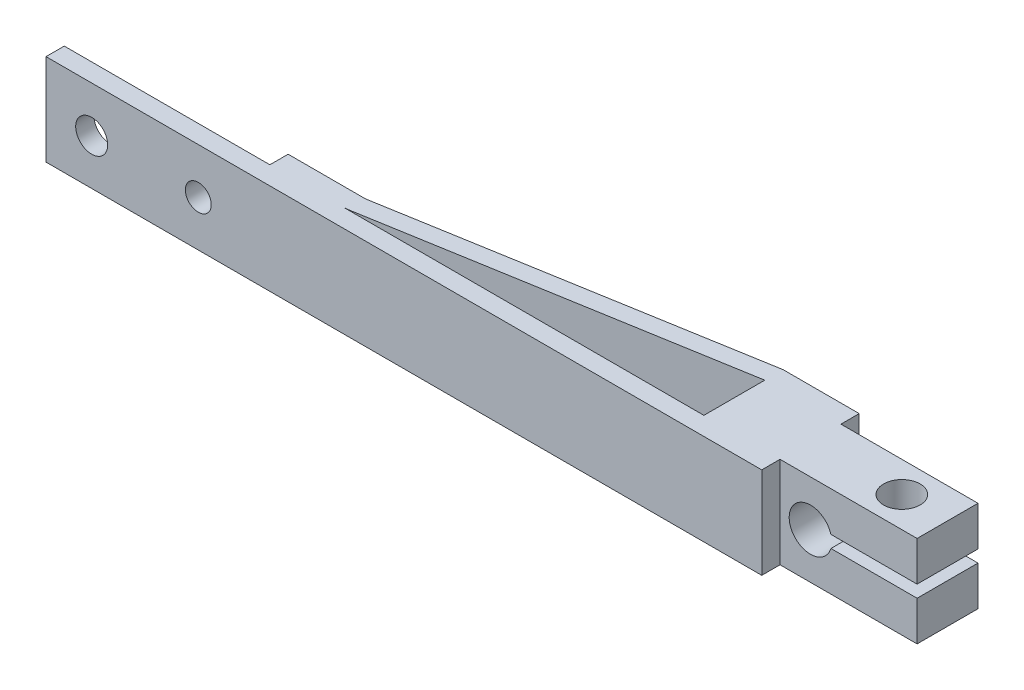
SolidWorks part; units mm, degrees
ref_plane "Plan1" through (0, 0, 0) normal (0, 0, 1) x (1, 0, 0)
ref_plane "Plan2" through (0, 0, 0) normal (0, 1, 0) x (1, 0, 0)
ref_plane "Plan3" through (0, 0, 0) normal (1, 0, 0) x (0, 0, -1)
sketch "Esquisse1" plane through (0, 0, 0) normal (0, 0, 1) x (1, 0, 0)
  line L0 (70, 17) -> (70, 30)
  line L1 (0, 0) -> (70, 0)
  line L2 (0, 0) -> (0, 30)
  line L3 (0, 30) -> (70, 30)
  line L4 (70, 0) -> (70, 13)
  line L5 (70, 17) -> (41.7082, 17)
  line L7 (70, 13) -> (41.7082, 13)
  arc A0 (41.7082, 17) -> (41.7082, 13) centre (35, 15) ccw
  dimension "D6" = 14
  dimension "D1" = 70
  dimension "D2" = 30
  dimension "D3" = 4
  dimension "D4" = 13
extrude "Accorche" add sketch "Esquisse1" along normal blind 20
sketch "Esquisse2" plane through (0, 30, 0) normal (0, 1, 0) x (-1, 0, 0)
  line L0 (-70, 20) -> (-70, 0) construction
  circle A0 centre (-55, 10) radius 6
  dimension "D1" = 12
  dimension "D2" = 15
  dimension "D3" = 10
extrude "Perçage pour vis de serrage" cut sketch "Esquisse2" against normal through all
sketch "Esquisse3" plane through (0, 0, 20) normal (0, 0, 1) x (1, 0, 0)
  line L0 (70, 30) -> (0, 30) construction
  line L1 (25, 30) -> (-210, 30)
  line L2 (25, 30) -> (25, 0)
  line L3 (25, 0) -> (-210, 0)
  line L4 (-210, 30) -> (-210, 0)
  circle A0 centre (-195, 15) radius 5.25
  circle A1 centre (-160, 15) radius 4.25
  dimension "D3" = 10.5
  dimension "D6" = 8.5
  dimension "D7" = 35
  dimension "D1" = 25
  dimension "D2" = 235
  dimension "D4" = 15
  dimension "D5" = 15
  dimension "D8" = 15
  dimension "D9" = 30
extrude "levier" add sketch "Esquisse3" along normal blind 6
sketch "Esquisse4" plane through (0, 30, 0) normal (0, 1, 0) x (-1, 0, 0)
  line L0 (0, 0) -> (116.1672, 19.7731)
  line L1 (0, 20) -> (210, 20) construction
  line L2 (-25, 26) -> (-25, 20) construction
  line L3 (118.852, 20) -> (142.5, 20)
  line L5 (117.9248, 14) -> (142.5, 14)
  line L6 (142.5, 20) -> (142.5, 14)
  line L7 (0, 0) -> (-25, 0)
  line L9 (0, -6) -> (-25, -6)
  line L10 (-25, 0) -> (-25, -6)
  line L11 (0, -6) -> (116.2409, 13.8572)
  arc A0 (117.9248, 14) -> (116.2409, 13.8572) centre (117.9248, 4) ccw
  arc A1 (118.852, 20) -> (116.1672, 19.7731) centre (118.852, 4) ccw
  point P17 (117.5, 20)
  dimension "D5" = 10
  dimension "D6" = 16
  dimension "D1" = 117.5
  dimension "D2" = 25
  dimension "D3" = 6
  dimension "D4" = 6
extrude "renfort" add sketch "Esquisse4" against normal blind 30
